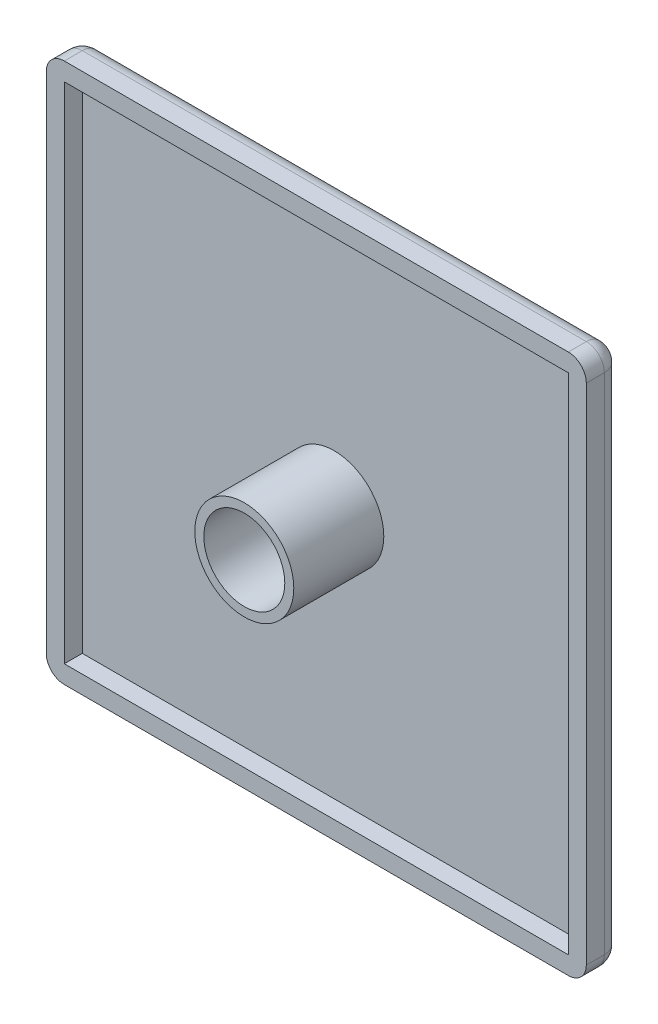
SolidWorks part; units mm, degrees
ref_plane "前视基准面" through (0, 0, 0) normal (0, 0, 1) x (1, 0, 0)
ref_plane "上视基准面" through (0, 0, 0) normal (0, 1, 0) x (1, 0, 0)
ref_plane "右视基准面" through (0, 0, 0) normal (1, 0, 0) x (0, 0, -1)
sketch "草图1" plane through (0, 0, 0) normal (0, 0, 1) x (1, 0, 0)
  line L1 (-30, 30) -> (30, 30)
  line L2 (-30, 30) -> (-30, -30)
  line L3 (-30, -30) -> (30, -30)
  line L4 (30, 30) -> (30, -30)
  dimension "D1" = 60
  dimension "D2" = 60
  dimension "D3" = 30
extrude "凸台-拉伸1" add sketch "草图1" along normal mid plane 4
shell "抽壳1" thickness 2
fillet "圆角2" radius 2 8 edges at (-30, 30, 0) (30, -30, 0) (-30, -30, 0) (-30, 0, -2) (0, -30, -2) (30, 0, -2) (0, 30, -2) (30, 30, 0)
sketch "草图3" plane through (0, 0, 0) normal (0, 0, 1) x (1, 0, 0)
  circle A0 centre (0, 0) radius 5.5
  circle A1 centre (0, 0) radius 4.5
extrude "凸台-拉伸3" add sketch "草图3" along normal blind 10
